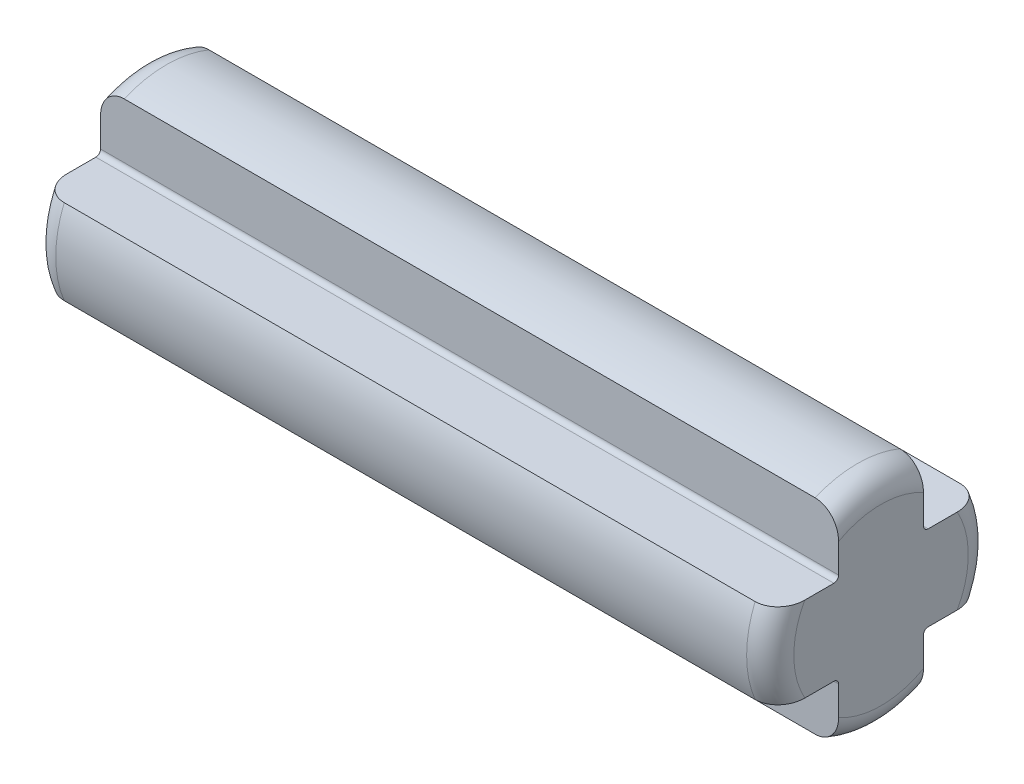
SolidWorks part; units mm, degrees
ref_plane "Alzado" through (0, 0, 0) normal (0, 0, 1) x (1, 0, 0)
ref_plane "Planta" through (0, 0, 0) normal (0, 1, 0) x (1, 0, 0)
ref_plane "Vista lateral" through (0, 0, 0) normal (1, 0, 0) x (0, 0, -1)
sketch "Croquis1" plane through (0, 0, 0) normal (1, 0, 0) x (0, 0, -1)
  line L0 (-3.7919, 0) -> (3.9132, 0) construction
  line L1 (-0.9, 2.1708) -> (-0.9, 1)
  line L2 (-2.1708, 0.9) -> (-1, 0.9)
  line L3 (2.1708, 0.9) -> (1, 0.9)
  line L4 (0.9, 2.1708) -> (0.9, 1)
  line L5 (0, 3.4809) -> (0, -0.8787) construction
  line L6 (0.9, -2.1708) -> (0.9, -1)
  line L7 (2.1708, -0.9) -> (1, -0.9)
  line L8 (-2.1708, -0.9) -> (-1, -0.9)
  line L9 (-0.9, -2.1708) -> (-0.9, -1)
  arc A0 (-2.1708, 0.9) -> (-2.1708, -0.9) centre (0, 0) ccw
  arc A1 (0.9, 2.1708) -> (-0.9, 2.1708) centre (0, 0) ccw
  arc A2 (-1, 0.9) -> (-0.9, 1) centre (-1, 1) ccw
  arc A3 (1, 0.9) -> (0.9, 1) centre (1, 1) cw
  arc A4 (2.1708, 0.9) -> (2.1708, -0.9) centre (0, 0) cw
  arc A5 (1, -0.9) -> (0.9, -1) centre (1, -1) ccw
  arc A6 (-1, -0.9) -> (-0.9, -1) centre (-1, -1) cw
  arc A7 (0.9, -2.1708) -> (-0.9, -2.1708) centre (0, 0) cw
  dimension "D1" = 2.35
  dimension "D4" = 0.1
  dimension "D2" = 1.8
  dimension "D3" = 1.8
extrude "Extruir1" add sketch "Croquis1" along normal mid plane 15.65
fillet "Redondeo1" radius 0.5 8 edges at (7.825, 2.35, 0) (7.825, 0, -2.35) (7.825, -2.35, 0) (7.825, 0, 2.35) (-7.825, -2.35, 0) (-7.825, 0, -2.35) (-7.825, 2.35, 0) (-7.825, 0, 2.35)
